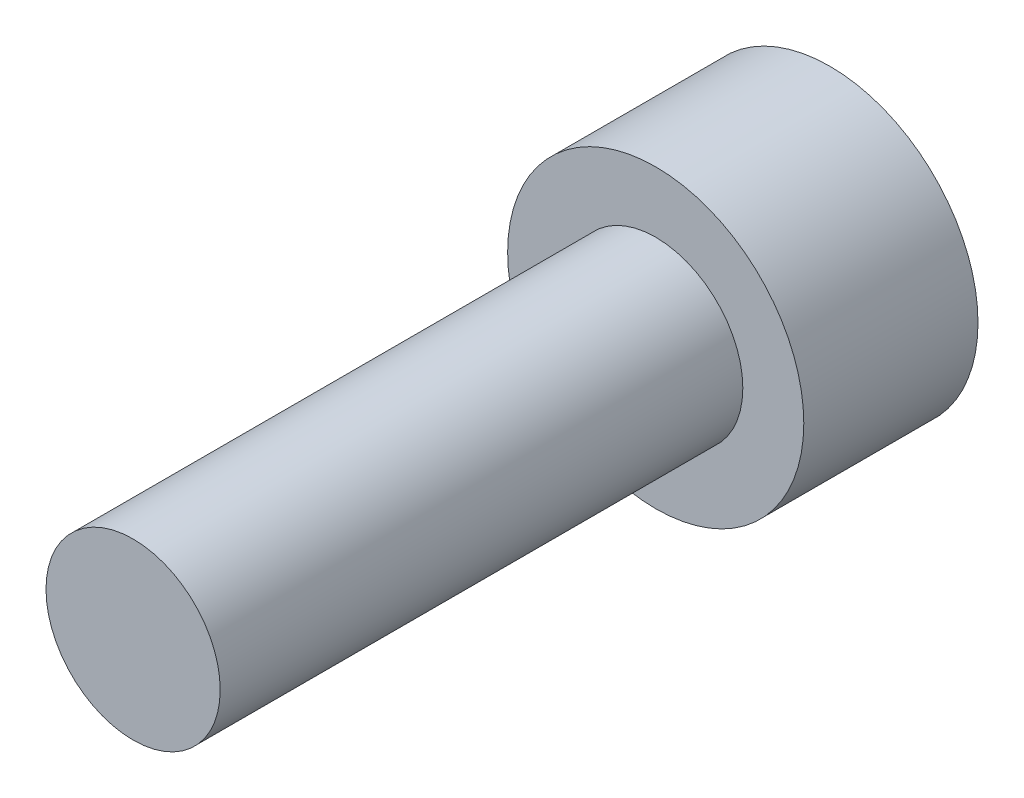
SolidWorks part; units mm, degrees
ref_plane "Front Plane" through (0, 0, 0) normal (0, 0, 1) x (1, 0, 0)
ref_plane "Top Plane" through (0, 0, 0) normal (0, 1, 0) x (1, 0, 0)
ref_plane "Right Plane" through (0, 0, 0) normal (1, 0, 0) x (0, 0, -1)
sketch "Sketch6" plane through (0, 0, 0) normal (1, 0, 0) x (0, 0, -1)
  line L0 (-15, 0) -> (22.525, 0) construction
  line L1 (4.675, 0) -> (-4.675, 0) construction
  line L2 (-15, 0) -> (-15, -2.5)
  line L3 (-15, -2.5) -> (0, -2.5)
  line L4 (0, 4.675) -> (0, -4.675) construction
  line L5 (0, -2.5) -> (0, -4.25)
  line L6 (0, -4.25) -> (5, -4.25)
  line L7 (5, -4.25) -> (5, 0)
  line L8 (5, 0) -> (-15, 0)
  dimension "L" = 15
  dimension "H" = 5
  dimension "A" = 8.5
  dimension "D" = 5
revolve "Revolve1" add sketch "Sketch6" angle 360 about L0
sketch "Sketch7" plane through (0, 0, -5) normal (0, 0, -1) x (-1, 0, 0)
  line L2 (-2, 1.1547) -> (-2, -1.1547)
  line L4 (-2, -1.1547) -> (0, -2.3094)
  line L5 (0, -2.3094) -> (2, -1.1547)
  line L6 (2, -1.1547) -> (2, 1.1547)
  line L7 (2, 1.1547) -> (0, 2.3094)
  line L8 (0, 2.3094) -> (-2, 1.1547)
  circle A0 centre (0, 0) radius 2 construction
  dimension "J" = 4
extrude "HEX" cut sketch "Sketch7" against normal blind 4
